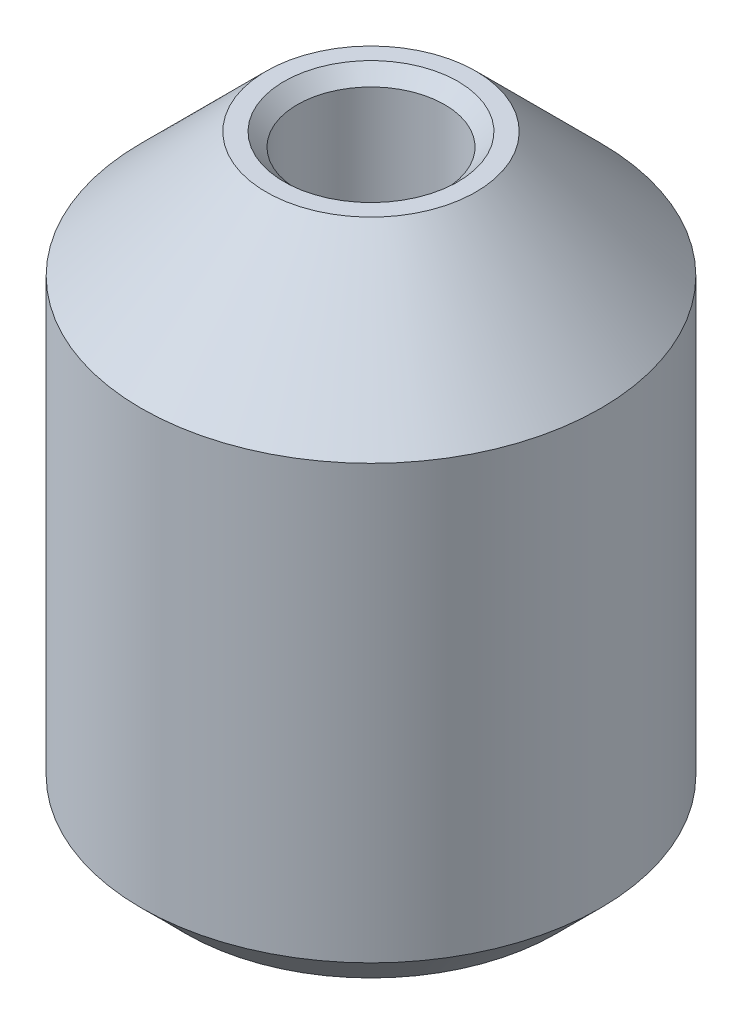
SolidWorks part; units mm, degrees
ref_plane "Plan de face" through (0, 0, 0) normal (0, 0, 1) x (1, 0, 0)
ref_plane "Plan de dessus" through (0, 0, 0) normal (0, 1, 0) x (1, 0, 0)
ref_plane "Plan de droite" through (0, 0, 0) normal (1, 0, 0) x (0, 0, -1)
sketch "Esquisse2" plane through (0, 0, 0) normal (0, 0, 1) x (1, 0, 0)
  line L0 (0, 0) -> (0, 22.7557) construction
  line L1 (-4.7, 27) -> (-3.3, 27)
  line L2 (-3.3, 27) -> (-3.3, 13.5)
  line L3 (-1.8, 12) -> (0, 12)
  line L4 (0, 12) -> (0, 0)
  line L5 (0, 0) -> (-8.3, 0)
  line L6 (-10.3, 2) -> (-10.3, 21.4)
  line L7 (-8.3, 0) -> (-10.3, 2)
  line L8 (-10.3, 21.4) -> (-4.7, 27)
  arc A0 (-3.3, 13.5) -> (-1.8, 12) centre (-1.8, 13.5) ccw
  point P3 (-10.3, 27)
  point P12 (-10.3, 0)
  dimension "D5" = 1.5
  dimension "D1" = 7
  dimension "D2" = 6.6
  dimension "D3" = 12
  dimension "D4" = 15
  dimension "D6" = 20.6
  dimension "D7" = 27
revolve "Révolution1" add sketch "Esquisse2" angle 360 about L0
sketch "Esquisse3" plane through (0, 0, 0) normal (0, -1, 0) x (1, 0, 0)
  line L0 (0, -2.5) -> (0, 2.5) construction
  line L1 (-1.875, -2.3419) -> (-1.875, 2.3419)
  line L2 (1.875, -2.3419) -> (1.875, 2.3419)
  arc A0 (1.875, 2.3419) -> (-1.875, 2.3419) centre (0, 0) ccw
  arc A2 (-1.875, -2.3419) -> (1.875, -2.3419) centre (0, 0) ccw
  point P2 (0, 0)
  dimension "D3" = 6
  dimension "D1" = 3.75
  dimension "D2" = 5
extrude "Enlèv. mat.-Extru.1" cut sketch "Esquisse3" against normal blind 9
chamfer "Chanfrein1" distance 0.6 angle 45 1 edges at (0, 27, -3.3)
chamfer "Chanfrein2" distance 0.75 angle 45 4 edges at (0, 0, 3) (-1.875, 0, 0) (0, 0, -3) (1.875, 0, 0)
